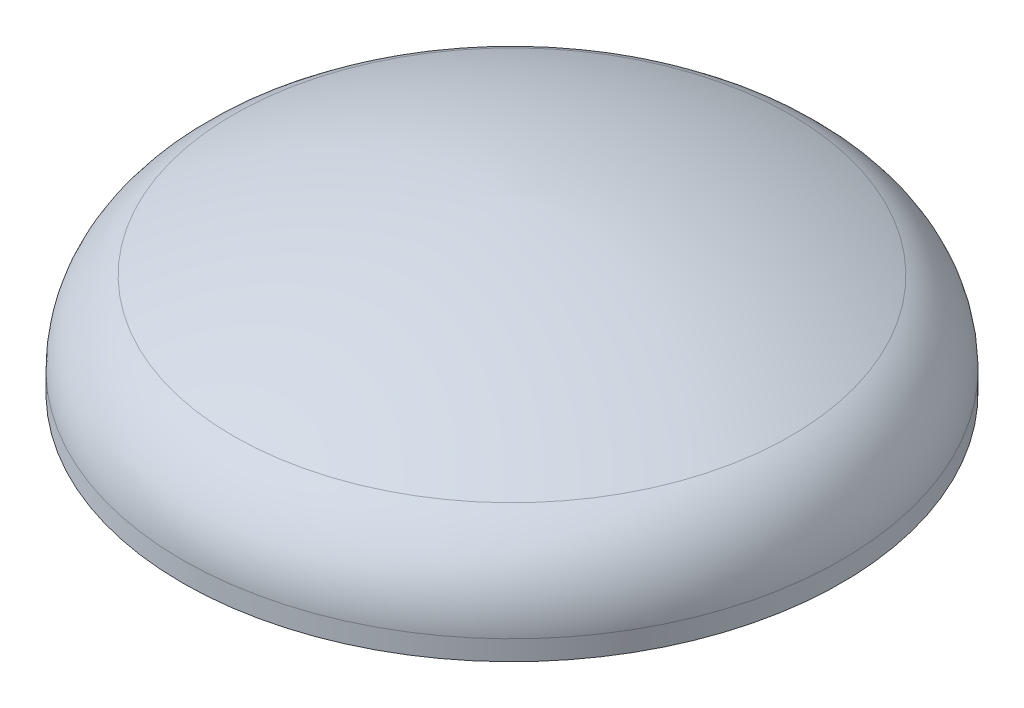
SolidWorks part; units mm, degrees
ref_plane "Plan de face" through (0, 0, 0) normal (0, 0, 1) x (1, 0, 0)
ref_plane "Plan de dessus" through (0, 0, 0) normal (0, 1, 0) x (1, 0, 0)
ref_plane "Plan de droite" through (0, 0, 0) normal (1, 0, 0) x (0, 0, -1)
sketch "Esquisse1" plane through (0, 0, 0) normal (0, 0, 1) x (1, 0, 0)
  line L0 (0, 18.1666) -> (0, -17.8372) construction
  line L1 (-35.15, 0.6707) -> (-35.15, 4.6367)
  line L2 (-35.15, 0.6707) -> (-38.05, 2.3451)
  line L3 (-38.05, 2.3451) -> (-38.05, 4.6367)
  line L4 (-35.15, 0.6707) -> (-50.2108, 0.6707) construction
  line L5 (0, 19.1707) -> (0, 22.0707)
  arc A0 (0, 19.1707) -> (-30.8841, 11.4726) centre (2.5565, -56.8863) ccw
  arc A1 (-30.8841, 11.4726) -> (-35.15, 4.6367) centre (-27.54, 4.6367) ccw
  arc A2 (-32.1584, 14.0776) -> (-38.05, 4.6367) centre (-27.54, 4.6367) ccw
  arc A3 (0, 22.0707) -> (-32.1584, 14.0776) centre (2.553, -56.888) ccw
  dimension "D2" = 76.1
  dimension "D11" = 79
  dimension "D1" = 35.15
  dimension "D4" = 18.5
  dimension "D6" = 2.9
  dimension "D9" = 30
revolve "Révolution1" add sketch "Esquisse1" angle 360 about L0
